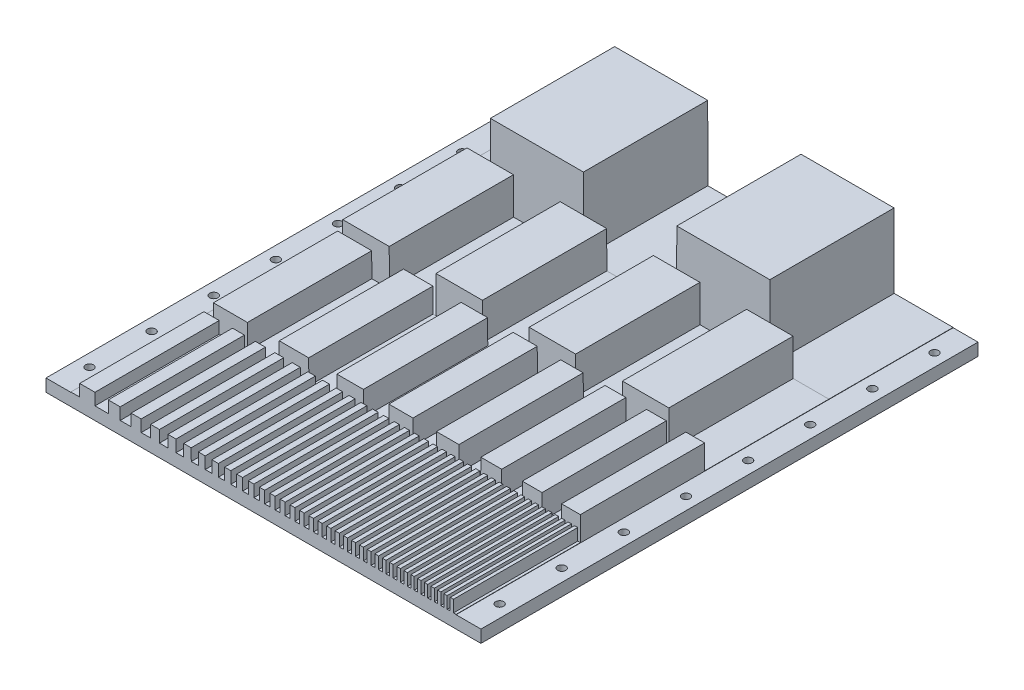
SolidWorks part; units mm, degrees
ref_plane "Front Plane" through (0, 0, 0) normal (0, 0, 1) x (1, 0, 0)
ref_plane "Top Plane" through (0, 0, 0) normal (0, 1, 0) x (1, 0, 0)
ref_plane "Right Plane" through (0, 0, 0) normal (1, 0, 0) x (0, 0, -1)
imported_body "squareRow3-1-solid1"
imported_body "squareRow4-1-solid1"
imported_body "squareRow1-1-solid1"
imported_body "squareRow2-1-solid1"
combine bodies "Combine1" operation type add bodies to combine 103 104 101 102
